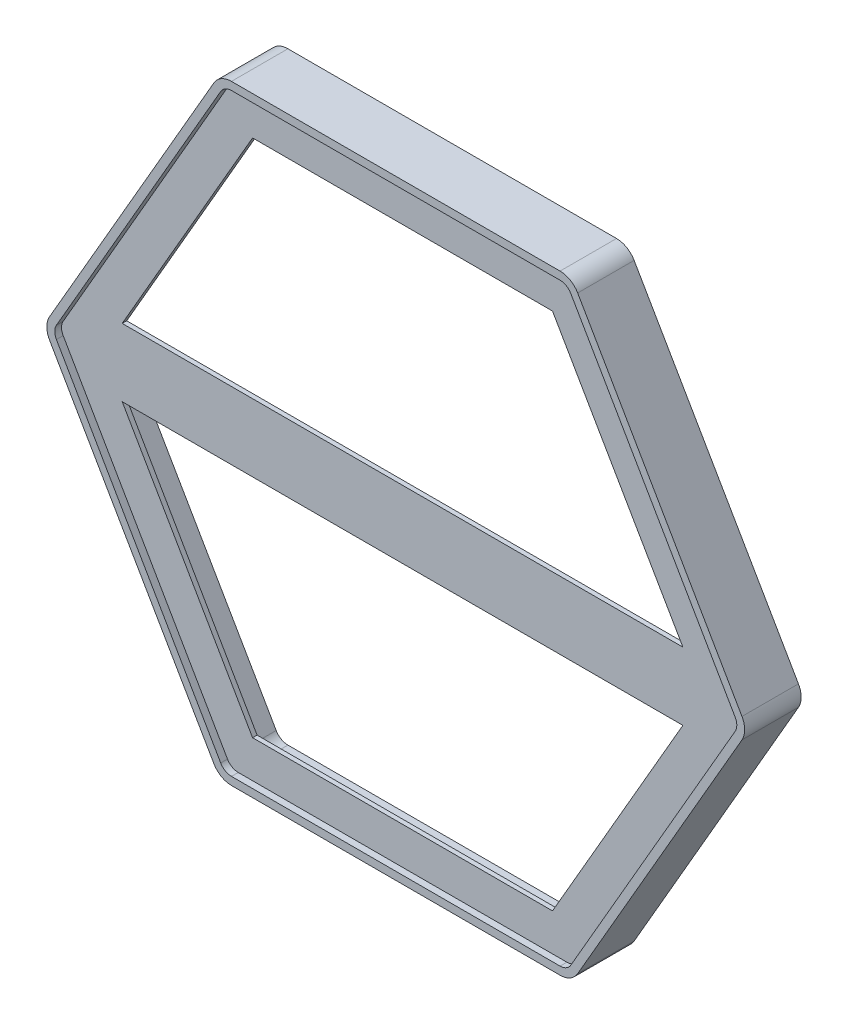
SolidWorks part; units mm, degrees
ref_plane "Front Plane" through (0, 0, 0) normal (0, 0, 1) x (1, 0, 0)
ref_plane "Top Plane" through (0, 0, 0) normal (0, 1, 0) x (1, 0, 0)
ref_plane "Right Plane" through (0, 0, 0) normal (1, 0, 0) x (0, 0, -1)
sketch "Sketch1" plane through (0, 0, 0) normal (0, 0, 1) x (1, 0, 0)
  line L12 (102.2863, -165.735) -> (194.6739, -5.715)
  line L13 (194.6739, 5.715) -> (102.2863, 165.735)
  line L14 (92.3876, 171.45) -> (-92.3876, 171.45)
  line L15 (-102.2863, 165.735) -> (-194.6739, 5.715)
  line L16 (-194.6739, -5.715) -> (-102.2863, -165.735)
  line L17 (-92.3876, -171.45) -> (92.3876, -171.45)
  line L18 (102.2863, -165.735) -> (194.6739, -5.715)
  line L19 (194.6739, 5.715) -> (102.2863, 165.735)
  line L20 (92.3876, 171.45) -> (-92.3876, 171.45)
  line L21 (-102.2863, 165.735) -> (-194.6739, 5.715)
  line L22 (-194.6739, -5.715) -> (-102.2863, -165.735)
  line L23 (-92.3876, -171.45) -> (92.3876, -171.45)
  arc A12 (92.3876, -171.45) -> (102.2863, -165.735) centre (92.3876, -160.02) ccw
  arc A13 (194.6739, -5.715) -> (194.6739, 5.715) centre (184.7752, 0) ccw
  arc A14 (102.2863, 165.735) -> (92.3876, 171.45) centre (92.3876, 160.02) ccw
  arc A15 (-92.3876, 171.45) -> (-102.2863, 165.735) centre (-92.3876, 160.02) ccw
  arc A16 (-194.6739, 5.715) -> (-194.6739, -5.715) centre (-184.7752, 0) ccw
  arc A17 (-102.2863, -165.735) -> (-92.3876, -171.45) centre (-92.3876, -160.02) ccw
  arc A18 (92.3876, -171.45) -> (102.2863, -165.735) centre (92.3876, -160.02) ccw
  arc A19 (194.6739, -5.715) -> (194.6739, 5.715) centre (184.7752, 0) ccw
  arc A20 (102.2863, 165.735) -> (92.3876, 171.45) centre (92.3876, 160.02) ccw
  arc A21 (-92.3876, 171.45) -> (-102.2863, 165.735) centre (-92.3876, 160.02) ccw
  arc A22 (-194.6739, 5.715) -> (-194.6739, -5.715) centre (-184.7752, 0) ccw
  arc A23 (-102.2863, -165.735) -> (-92.3876, -171.45) centre (-92.3876, -160.02) ccw
  dimension "D1" = 6.35
extrude "Extrude1" add sketch "Sketch1" along normal blind 6.35
sketch "Sketch3" plane through (0, 0, 0) normal (0, 0, -1) x (-1, 0, 0)
  line L0 (-92.3876, 171.45) -> (92.3876, 171.45) construction
  line L1 (102.2863, 165.735) -> (194.6739, 5.715) construction
  line L2 (194.6739, -5.715) -> (102.2863, -165.735) construction
  line L3 (92.3876, -171.45) -> (-92.3876, -171.45) construction
  line L4 (-102.2863, -165.735) -> (-194.6739, -5.715) construction
  line L5 (-194.6739, 5.715) -> (-102.2863, 165.735) construction
  line L6 (-92.3876, 171.45) -> (92.3876, 171.45)
  line L7 (102.2863, 165.735) -> (194.6739, 5.715)
  line L8 (194.6739, -5.715) -> (102.2863, -165.735)
  line L9 (92.3876, -171.45) -> (-92.3876, -171.45)
  line L10 (-102.2863, -165.735) -> (-194.6739, -5.715)
  line L11 (-194.6739, 5.715) -> (-102.2863, 165.735)
  line L12 (-191.3743, 3.81) -> (-98.9867, 163.83)
  line L13 (-92.3876, 167.64) -> (92.3876, 167.64)
  line L14 (98.9867, 163.83) -> (191.3743, 3.81)
  line L15 (191.3743, -3.81) -> (98.9867, -163.83)
  line L16 (92.3876, -167.64) -> (-92.3876, -167.64)
  line L17 (-98.9867, -163.83) -> (-191.3743, -3.81)
  arc A0 (-92.3876, 171.45) -> (-102.2863, 165.735) centre (-92.3876, 160.02) ccw construction
  arc A1 (102.2863, 165.735) -> (92.3876, 171.45) centre (92.3876, 160.02) ccw construction
  arc A2 (194.6739, -5.715) -> (194.6739, 5.715) centre (184.7752, 0) ccw construction
  arc A3 (92.3876, -171.45) -> (102.2863, -165.735) centre (92.3876, -160.02) ccw construction
  arc A4 (-102.2863, -165.735) -> (-92.3876, -171.45) centre (-92.3876, -160.02) ccw construction
  arc A5 (-194.6739, 5.715) -> (-194.6739, -5.715) centre (-184.7752, 0) ccw construction
  arc A6 (-92.3876, 171.45) -> (-102.2863, 165.735) centre (-92.3876, 160.02) ccw
  arc A7 (102.2863, 165.735) -> (92.3876, 171.45) centre (92.3876, 160.02) ccw
  arc A8 (194.6739, -5.715) -> (194.6739, 5.715) centre (184.7752, 0) ccw
  arc A9 (92.3876, -171.45) -> (102.2863, -165.735) centre (92.3876, -160.02) ccw
  arc A10 (-102.2863, -165.735) -> (-92.3876, -171.45) centre (-92.3876, -160.02) ccw
  arc A11 (-194.6739, 5.715) -> (-194.6739, -5.715) centre (-184.7752, 0) ccw
  arc A12 (-92.3876, 167.64) -> (-98.9867, 163.83) centre (-92.3876, 160.02) ccw
  arc A13 (98.9867, 163.83) -> (92.3876, 167.64) centre (92.3876, 160.02) ccw
  arc A14 (191.3743, -3.81) -> (191.3743, 3.81) centre (184.7752, 0) ccw
  arc A15 (92.3876, -167.64) -> (98.9867, -163.83) centre (92.3876, -160.02) ccw
  arc A16 (-98.9867, -163.83) -> (-92.3876, -167.64) centre (-92.3876, -160.02) ccw
  arc A17 (-191.3743, 3.81) -> (-191.3743, -3.81) centre (-184.7752, 0) ccw
  dimension "D1" = 3.81
extrude "Extrude2" add sketch "Sketch3" along normal blind 25.4
sketch "Sketch4" plane through (0, 0, 6.35) normal (0, 0, 1) x (1, 0, 0)
  line L6 (-168.644, 0) -> (168.644, 0) construction
  line L7 (-157.6455, -19.05) -> (157.6455, -19.05)
  line L8 (-157.6455, 19.05) -> (157.6455, 19.05)
  line L9 (-168.644, 19.05) -> (168.644, 19.05) construction
  line L10 (-168.644, -19.05) -> (168.644, -19.05) construction
  line L12 (84.322, -146.05) -> (168.644, 0)
  line L13 (168.644, 0) -> (84.322, 146.05)
  line L14 (84.322, 146.05) -> (-84.322, 146.05)
  line L15 (-84.322, 146.05) -> (-168.644, 0)
  line L16 (-168.644, 0) -> (-84.322, -146.05)
  line L17 (-84.322, -146.05) -> (84.322, -146.05)
  line L18 (84.322, -146.05) -> (157.6455, -19.05)
  line L19 (157.6455, 19.05) -> (84.322, 146.05)
  line L20 (84.322, 146.05) -> (-84.322, 146.05)
  line L21 (-84.322, 146.05) -> (-157.6455, 19.05)
  line L22 (-157.6455, -19.05) -> (-84.322, -146.05)
  line L23 (-84.322, -146.05) -> (84.322, -146.05)
  dimension "D1" = 25.4
  dimension "D2" = 19.05
  dimension "D3" = 19.05
extrude "Cut-Extrude1" cut sketch "Sketch4" against normal through all
sketch "Sketch6" plane through (0, 0, 6.35) normal (0, 0, 1) x (1, 0, 0)
  line L12 (190.8244, 3.4925) -> (98.4368, 163.5125)
  line L13 (92.3876, 167.005) -> (-92.3876, 167.005)
  line L14 (-98.4368, 163.5125) -> (-190.8244, 3.4925)
  line L15 (-190.8244, -3.4925) -> (-98.4368, -163.5125)
  line L16 (-92.3876, -167.005) -> (92.3876, -167.005)
  line L17 (98.4368, -163.5125) -> (190.8244, -3.4925)
  line L18 (190.8244, 3.4925) -> (98.4368, 163.5125)
  line L19 (92.3876, 167.005) -> (-92.3876, 167.005)
  line L20 (-98.4368, 163.5125) -> (-190.8244, 3.4925)
  line L21 (-190.8244, -3.4925) -> (-98.4368, -163.5125)
  line L22 (-92.3876, -167.005) -> (92.3876, -167.005)
  line L23 (98.4368, -163.5125) -> (190.8244, -3.4925)
  arc A12 (190.8244, -3.4925) -> (190.8244, 3.4925) centre (184.7752, 0) ccw
  arc A13 (98.4368, 163.5125) -> (92.3876, 167.005) centre (92.3876, 160.02) ccw
  arc A14 (-92.3876, 167.005) -> (-98.4368, 163.5125) centre (-92.3876, 160.02) ccw
  arc A15 (-190.8244, 3.4925) -> (-190.8244, -3.4925) centre (-184.7752, 0) ccw
  arc A16 (-98.4368, -163.5125) -> (-92.3876, -167.005) centre (-92.3876, -160.02) ccw
  arc A17 (92.3876, -167.005) -> (98.4368, -163.5125) centre (92.3876, -160.02) ccw
  arc A18 (190.8244, -3.4925) -> (190.8244, 3.4925) centre (184.7752, 0) ccw
  arc A19 (98.4368, 163.5125) -> (92.3876, 167.005) centre (92.3876, 160.02) ccw
  arc A20 (-92.3876, 167.005) -> (-98.4368, 163.5125) centre (-92.3876, 160.02) ccw
  arc A21 (-190.8244, 3.4925) -> (-190.8244, -3.4925) centre (-184.7752, 0) ccw
  arc A22 (-98.4368, -163.5125) -> (-92.3876, -167.005) centre (-92.3876, -160.02) ccw
  arc A23 (92.3876, -167.005) -> (98.4368, -163.5125) centre (92.3876, -160.02) ccw
  dimension "D1" = 4.445
extrude "Cut-Extrude2" cut sketch "Sketch6" against normal blind 3.81
